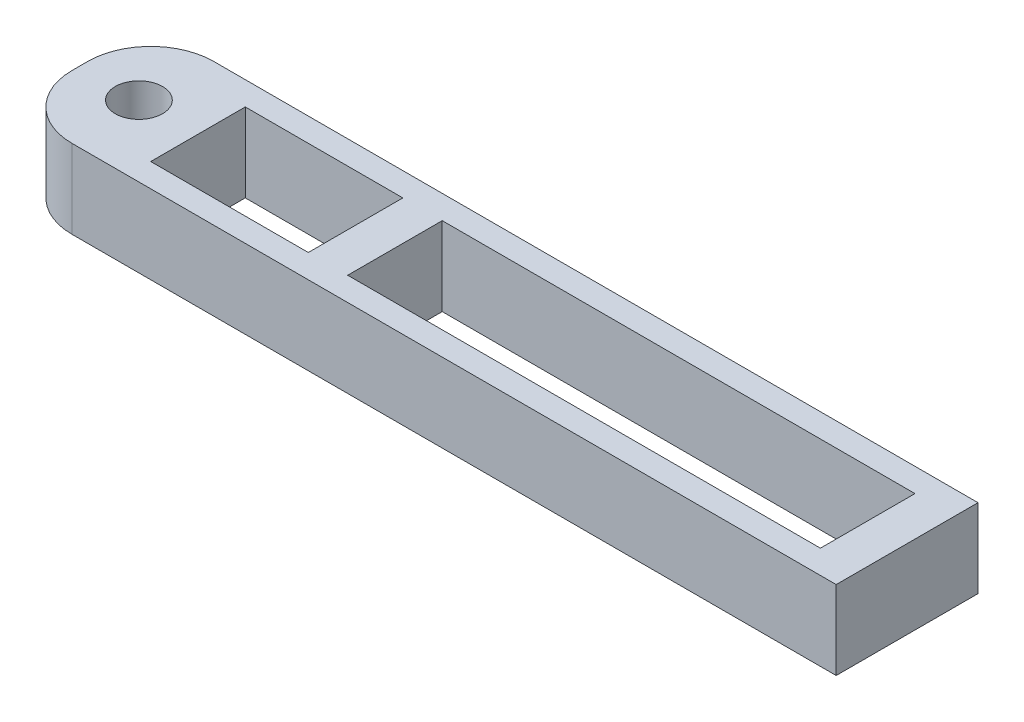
SolidWorks part; units mm, degrees
ref_plane "Front Plane" through (0, 0, 0) normal (0, 0, 1) x (1, 0, 0)
ref_plane "Top Plane" through (0, 0, 0) normal (0, 1, 0) x (1, 0, 0)
ref_plane "Right Plane" through (0, 0, 0) normal (1, 0, 0) x (0, 0, -1)
sketch "Sketch1" plane through (0, 0, 0) normal (1, 0, 0) x (0, 0, -1)
  line L1 (0, 0) -> (18, 0)
  line L2 (0, 0) -> (0, 10)
  line L3 (0, 10) -> (18, 10)
  line L4 (18, 0) -> (18, 10)
  dimension "D1" = 10
  dimension "D2" = 18
extrude "Boss-Extrude1" add sketch "Sketch1" along normal blind 15
sketch "Sketch2" plane through (0, 10, 0) normal (0, 1, 0) x (1, 0, 0)
  line L0 (7.5, 9) -> (7.5, 18) construction
  line L1 (15, 18) -> (0, 18) construction
  line L2 (7.5, 9) -> (7.5, 0) construction
  line L3 (15, 0) -> (0, 0) construction
  line L4 (7.5, 9) -> (15, 9) construction
  line L5 (15, 18) -> (15, 0) construction
  line L6 (7.5, 9) -> (0, 9) construction
  line L7 (0, 18) -> (0, 0) construction
  circle A0 centre (7.5, 9) radius 3
  dimension "D1" = 6
extrude "Cut-Extrude1" cut sketch "Sketch2" against normal through all contours A0
sketch "Sketch5" plane through (15, 0, 0) normal (1, 0, 0) x (0, 0, -1)
  line L0 (0, 0) -> (18, 0) construction
  line L1 (0, 10) -> (3, 10)
  line L2 (0, 10) -> (0, 0)
  line L3 (0, 0) -> (3, 0)
  line L4 (3, 10) -> (3, 0)
  line L5 (18, 0) -> (18, 10) construction
  line L6 (18, 10) -> (15, 10)
  line L7 (18, 10) -> (18, 0)
  line L8 (18, 0) -> (15, 0)
  line L9 (15, 10) -> (15, 0)
  dimension "D1" = 3
  dimension "D2" = 3
extrude "Boss-Extrude5" add sketch "Sketch5" along normal blind 40 contours L4 M12 M9 M10 | L7 L6 L9 L8
fillet "Fillet3" radius 8 1 edges at (0, 5, 0)
fillet "Fillet4" radius 8 1 edges at (0, 5, -18)
sketch "Sketch6" plane through (55, 0, 0) normal (1, 0, 0) x (0, 0, -1)
  line L1 (0, 10) -> (3, 10)
  line L2 (0, 10) -> (0, 0)
  line L3 (0, 0) -> (3, 0)
  line L4 (3, 10) -> (3, 0)
  line L5 (15, 10) -> (18, 10)
  line L6 (15, 10) -> (15, 0)
  line L7 (15, 0) -> (18, 0)
  line L8 (18, 10) -> (18, 0)
extrude "Boss-Extrude6" add sketch "Sketch6" along normal blind 50 contours L8 L5 L6 L7 | L2 L1 L4 L3
sketch "Sketch7" plane through (0, 0, 0) normal (0, 0, 1) x (1, 0, 0)
  line L0 (105, 0) -> (8, 0) construction
  line L1 (105, 10) -> (100, 10)
  line L2 (105, 10) -> (105, 0)
  line L3 (105, 0) -> (100, 0)
  line L4 (100, 10) -> (100, 0)
  dimension "D1" = 5
extrude "Boss-Extrude7" add sketch "Sketch7" against normal up to surface (15 mm away)
sketch "Sketch8" plane through (0, 0, 0) normal (0, 0, 1) x (1, 0, 0)
  line L0 (105, 10) -> (8, 10) construction
  line L1 (35, 10) -> (40, 10)
  line L2 (35, 10) -> (35, 0)
  line L3 (35, 0) -> (40, 0)
  line L4 (40, 10) -> (40, 0)
  line L5 (105, 0) -> (8, 0) construction
  line L6 (15, 10) -> (15, 0) construction
  dimension "D1" = 5
  dimension "D2" = 20
extrude "Boss-Extrude8" add sketch "Sketch8" against normal up to surface (15 mm away) contours L2 L1 L4 L3
